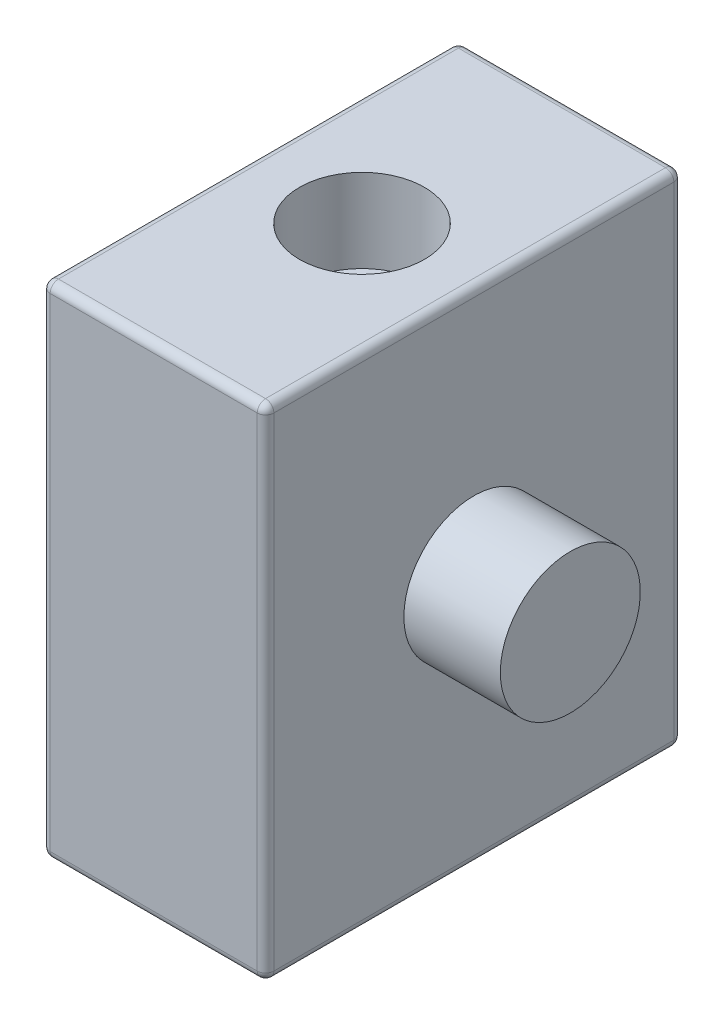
SolidWorks part; units mm, degrees
ref_plane "Front Plane" through (0, 0, 0) normal (0, 0, 1) x (1, 0, 0)
ref_plane "Top Plane" through (0, 0, 0) normal (0, 1, 0) x (1, 0, 0)
ref_plane "Right Plane" through (0, 0, 0) normal (1, 0, 0) x (0, 0, -1)
sketch "Sketch3" plane through (0, 0, 0) normal (1, 0, 0) x (0, 0, -1)
  line L1 (-31.75, 38.1) -> (31.75, 38.1)
  line L2 (-31.75, 38.1) -> (-31.75, -38.1)
  line L3 (-31.75, -38.1) -> (31.75, -38.1)
  line L4 (31.75, 38.1) -> (31.75, -38.1)
  line L5 (-31.75, 38.1) -> (31.75, -38.1) construction
  line L6 (-31.75, -38.1) -> (31.75, 38.1) construction
  point P0 (0, 0)
  dimension "D1" = 63.5
  dimension "D2" = 76.2
extrude "Boss-Extrude1" add sketch "Sketch3" along normal mid plane 34.1
sketch "Sketch4" plane through (-17.05, 0, 0) normal (-1, 0, 0) x (0, 0, 1)
  circle A0 centre (0, 0) radius 10.668
extrude "Boss-Extrude2" add sketch "Sketch4" along normal blind 14.7
sketch "Sketch5" plane through (0, 38.1, 0) normal (0, 1, 0) x (1, 0, 0)
  circle A0 centre (0, 0) radius 9.525
  dimension "D1" = 19.05
extrude "Cut-Extrude1" cut sketch "Sketch5" against normal blind 12.7
mirror "Mirror1" about plane through (0, 0, 0) normal (1, 0, 0) of "Boss-Extrude2"
fillet "Fillet1" radius 1.27
sketch "Sketch6" plane through (17.05, 0, 0) normal (1, 0, 0) x (0, 0, -1)
  circle A0 centre (0, 0) radius 10.668
  dimension "D1" = 21.336
